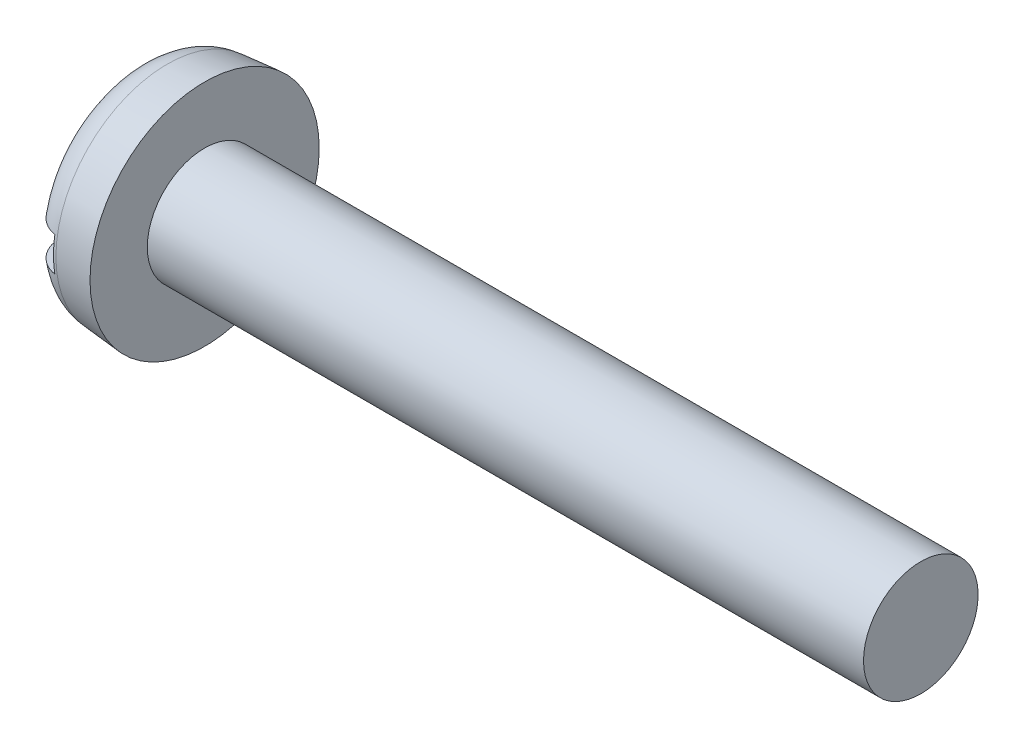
SolidWorks part; units mm, degrees
ref_plane "Plane1" through (0, 0, 0) normal (0, 0, 1) x (1, 0, 0)
ref_plane "Plane2" through (0, 0, 0) normal (0, 1, 0) x (1, 0, 0)
ref_plane "Plane3" through (0, 0, 0) normal (1, 0, 0) x (0, 0, -1)
sketch "BodySke" plane through (0, 0, 0) normal (0, 0, 1) x (1, 0, 0)
  line L0 (2.4, 2) -> (2.4, 4)
  line L1 (0, 0) -> (0, 3.79)
  line L2 (-25.4, 0) -> (127, 0) construction
  line L3 (27.4, 0) -> (0, 0)
  line L4 (2.4, 2) -> (27.4, 2)
  line L5 (27.4, 2) -> (27.4, 0)
  line L6 (0, 3.79) -> (2.4, 4)
  line L9 (3.1, 3.5875) -> (3.1, -5.9375) construction
  line L10 (2.4, 6.35) -> (2.4, -3.175) construction
revolve "Base-Revolve" add sketch "BodySke"
fillet "Fillet1" [suppressed] radius 0.2
fillet "Fillet2" radius 1.2 1 edges at (0, 0, 3.79)
sketch "Sketch2" plane through (0, 0, 0) normal (1, 0, 0) x (0, 0, -1)
  line L0 (4, -0.6) -> (-4, -0.6)
  line L1 (4, -0.6) -> (4, 0.6)
  line L2 (-4, 0.6) -> (4, 0.6)
  line L3 (-4, 0.6) -> (-4, -0.6)
extrude "Slot" cut sketch "Sketch2" along normal blind 1
sketch "ThdSchSke" plane through (0, 0, 0) normal (0, 0, 1) x (1, 0, 0)
  line L0 (3.8, -1.61) -> (3.5269, -2)
  line L1 (3.8, -1.61) -> (4.0731, -2)
  line L2 (4.0731, -2) -> (4.0731, -2.5)
  line L3 (-3.175, 0) -> (5.1513, 0) construction
  line L5 (4.0731, -2.5) -> (3.5269, -2.5)
  line L6 (3.5269, -2.5) -> (3.5269, -2)
revolve "ThreadSchematic" [suppressed] cut sketch "ThdSchSke" angle 360 about L3
pattern_linear "ThdSchPat" [suppressed]
equation "\"D1@Sketch2\" = \"Head_dia@BodySke\""
equation "\"D2@Sketch2\" = \"D1@Sketch2\" / 2"
equation "\"D3@Sketch2\" = \"Slot_width@Sketch2\" / 2"
equation "\"Thread_length@ThreadCosmetic\" = ((sgn( (\"Length@BodySke\" - \"Advance@BodySke\" * 2.0 ) - \"Thread_nom@BodySke\" )-1)*( (\"Length@BodySke\" - \"Advance@BodySke\"  * 2.0) - \"Thread_nom@BodySke\" ))/-2+ \"Thread_"
equation "\"Thread_minor@ThdSchSke\" = \"Thread_minor@ThreadCosmetic\""
equation "\"Diameter@ThdSchSke\" = \"Diameter@BodySke\""
equation "\"Overcut@ThdSchSke\" = \"Diameter@BodySke\" * 1.25"
equation "\"Start@ThdSchSke\" = \"Head_ht@BodySke\" + \"Length@BodySke\" - \"Thread_length@ThreadCosmetic\"  '---Non-countersunk---"
equation "\"Num_threads@ThdSchPat\" = int( \"Thread_length@ThreadCosmetic\" / \"Advance@BodySke\" + 0.999 )  + 1"
equation "\"Advance@ThdSchPat\" = \"Thread_length@ThreadCosmetic\" /  (\"Num_threads@ThdSchPat\" - 1) 'relax it"
